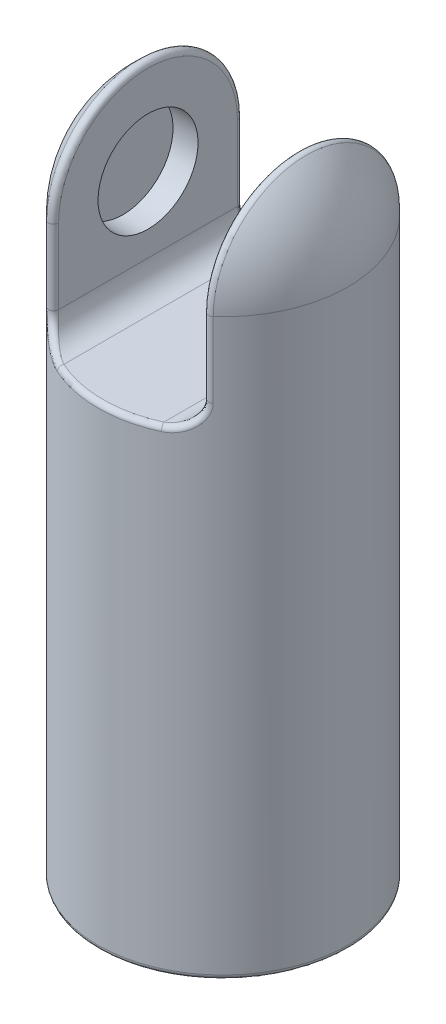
SolidWorks part; units mm, degrees
ref_plane "Front Plane" through (0, 0, 0) normal (0, 0, 1) x (1, 0, 0)
ref_plane "Top Plane" through (0, 0, 0) normal (0, 1, 0) x (1, 0, 0)
ref_plane "Right Plane" through (0, 0, 0) normal (1, 0, 0) x (0, 0, -1)
sketch "Sketch2" plane through (0, 0, 0) normal (0, 0, 1) x (1, 0, 0)
  line L0 (0, 2.9952) -> (0, -8.6128) construction
  line L1 (0, 0) -> (2.5, 0)
  line L2 (2.5, 0) -> (2.5, 11.5)
  line L3 (0, 14) -> (0, 0)
  arc A0 (2.5, 11.5) -> (0, 14) centre (0, 11.5) ccw
  point P8 (0, 0)
  point P9 (0, 0)
  point P10 (0, 2.9952)
  point P11 (0, 0)
  dimension "D1" = 5
  dimension "D2" = 14
revolve "Revolve1" add sketch "Sketch2" angle 360 about L0
ref_plane "Plane1" through (0, 0, 10) normal (0, 0, 1) x (1, 0, 0)
sketch "Sketch3" plane through (0, 0, 10) normal (0, 0, 1) x (1, 0, 0)
  line L0 (0, 0) -> (0, 9.5) construction
  line L2 (-1.5, 13.5) -> (-1.5, 10)
  line L3 (-1, 9.5) -> (1, 9.5)
  line L4 (1.5, 13.5) -> (1.5, 10)
  line L5 (2.5, 11.5) -> (-2.5, 11.5) construction
  arc A0 (2.5, 11.5) -> (-2.5, 11.5) centre (0, 11.5) ccw construction
  arc A1 (1.5, 13.5) -> (-1.5, 13.5) centre (0, 11.5) ccw
  arc A2 (1, 9.5) -> (1.5, 10) centre (1, 10) ccw
  arc A3 (-1.5, 10) -> (-1, 9.5) centre (-1, 10) ccw
  point P4 (0, 9.7586)
  dimension "D3" = 0.5
  dimension "D1" = 3
  dimension "D2" = 2
extrude "Cut-Extrude1" cut sketch "Sketch3" against normal through all
sketch "Sketch4" plane through (0, 0, 0) normal (1, 0, 0) x (0, 0, -1)
  line L0 (-2, 11.5) -> (2, 11.5) construction
  circle A0 centre (0, 11.5) radius 1
  dimension "D1" = 2
extrude "Cut-Extrude2" cut sketch "Sketch4" against normal offset from surface 0.5 and the other way offset from surface (2 mm away) 0.5
fillet "Fillet1" radius 0.1 12 edges at (1.5, 10.75, -2) (1.5, 10.75, 2) (1.3367, 9.6304, -2.1126) (1.4206, 9.7297, 2.0571) (0, 9.5, -2.5) (0, 9.5, 2.5) (-1.3367, 9.6304, 2.1126) (-1.4206, 9.7297, -2.0571) (-1.5, 10.75, 2) (-1.5, 10.75, -2) (-1.5, 13.5, 0) (1.5, 13.5, 0)
fillet "Fillet2" radius 0.1 1 edges at (0, 0, 2.5)
